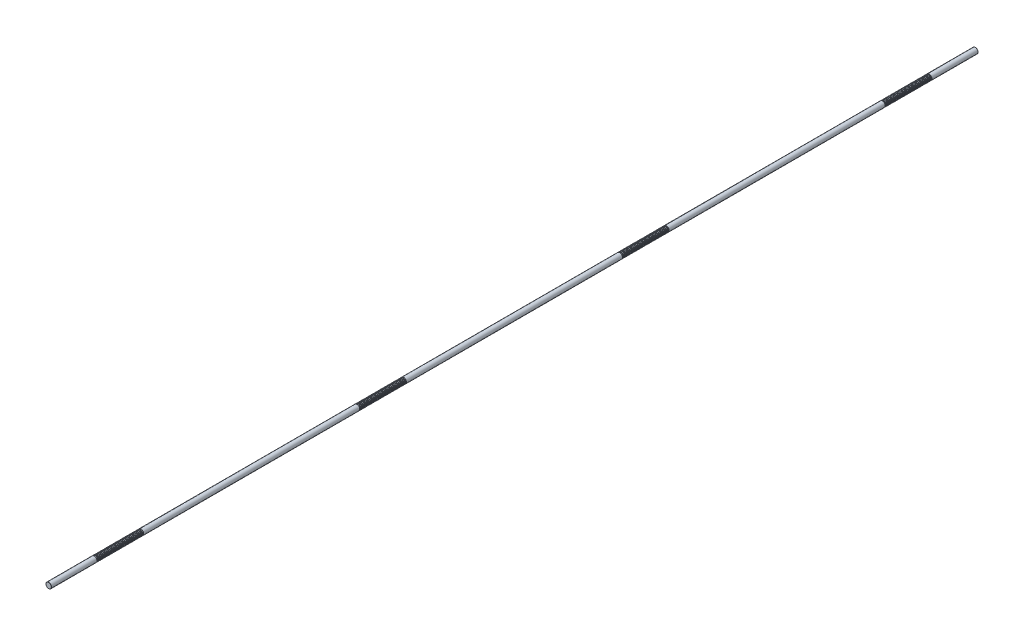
SolidWorks part; units mm, degrees
ref_plane "Front Plane" through (0, 0, 0) normal (0, 0, 1) x (1, 0, 0)
ref_plane "Top Plane" through (0, 0, 0) normal (0, 1, 0) x (1, 0, 0)
ref_plane "Right Plane" through (0, 0, 0) normal (1, 0, 0) x (0, 0, -1)
sketch "Sketch1" plane through (0, 0, 0) normal (0, 0, 1) x (1, 0, 0)
  circle A0 centre (0, 0) radius 6
  dimension "D1" = 12
extrude "Boss-Extrude1" add sketch "Sketch1" along normal mid plane 2000
chamfer "Chamfer1" distance 0.3 angle 45 2 edges at (6, 0, -1000) (6, 0, 1000)
sketch "Sketch2" plane through (0, 0, 0) normal (1, 0, 0) x (0, 0, -1)
  line L0 (900.2345, 6) -> (898.2655, 6)
  line L1 (999.7, 6) -> (-999.7, 6) construction
  line L2 (898.2655, 6) -> (898.7345, 4.25)
  line L3 (898.7345, 4.25) -> (899.7655, 4.25)
  line L4 (899.7655, 4.25) -> (900.2345, 6)
  line L5 (1000, -5.7) -> (1000, 5.7) construction
  point P4 (899.25, 6)
  point P7 (899.25, 4.25)
  point P8 (900, 5.125)
  point P9 (898.5, 5.125)
  dimension "D1" = 1.5
  dimension "D2" = 100
  dimension "D3" = 1.75
  dimension "D4" = 30
revolve "Cut-Revolve1" cut sketch "Sketch2" angle 360 about axis through (0, 0, 1000) along (0, 0, -1)
pattern_linear "LPattern1" count 34 spacing 3 along (0, 0, 1) of "Cut-Revolve1"
pattern_linear "LPattern2" count 4 spacing 567 along (0, 0, 1) of "Cut-Revolve1", "LPattern1"
